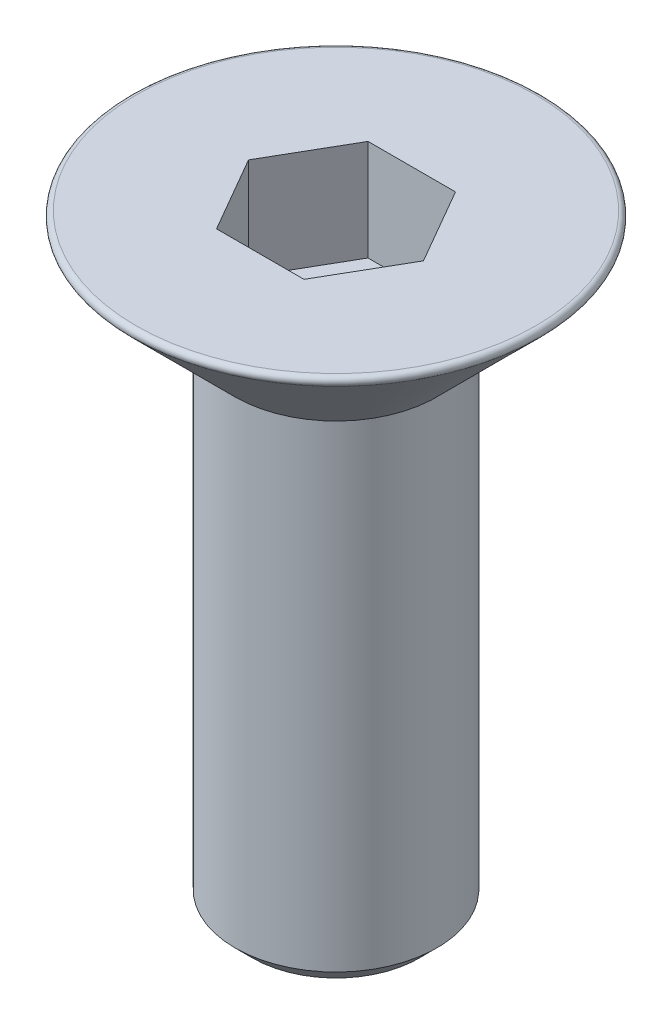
SolidWorks part; units mm, degrees
ref_plane "Plan1" through (0, 0, 0) normal (0, 0, 1) x (1, 0, 0)
ref_plane "Plan2" through (0, 0, 0) normal (0, 1, 0) x (1, 0, 0)
ref_plane "Plan3" through (0, 0, 0) normal (1, 0, 0) x (0, 0, -1)
sketch "Esquisse1" plane through (0, 0, 0) normal (0, 0, 1) x (1, 0, 0)
  line L0 (0, 7.3507) -> (0, -15.1588) construction
  line L1 (0, 0) -> (4.2, 0)
  line L2 (4.2, 0) -> (2, -2.2)
  line L3 (2, -2.2) -> (2, -12)
  line L4 (2, -12) -> (0, -12)
  line L5 (0, -12) -> (0, 0)
  dimension "D1" = 45
  dimension "D2" = 4
  dimension "D3" = 8.4
  dimension "D4" = 12
revolve "Base-Révolution" add sketch "Esquisse1" angle 360 about L0
sketch "Esquisse2" plane through (-0.4184, 0, 2.0942) normal (0, 1, 0) x (-1, 0, 0)
  line L0 (-0.4184, 0.1336) -> (-0.4184, -9.7892) construction
  line L1 (-2.9949, -2.0942) -> (7.5971, -2.0942) construction
  line L2 (0.4476, -0.5942) -> (1.3136, -2.0942)
  line L3 (0.4476, -0.5942) -> (-1.2844, -0.5942)
  line L4 (-1.2844, -0.5942) -> (-2.1505, -2.0942)
  line L5 (0.4476, -3.5942) -> (1.3136, -2.0942)
  line L6 (-1.2844, -3.5942) -> (-2.1505, -2.0942)
  line L7 (0.4476, -3.5942) -> (-1.2844, -3.5942)
  circle A0 centre (-0.4184, -2.0942) radius 1.7321 construction
  point P13 (-0.4184, -0.5942)
  dimension "D1" = 3
extrude "Enlèv. mat.-Extru.1" cut sketch "Esquisse2" against normal blind 2
chamfer "Chanfrein1" distance 0.35 angle 45
fillet "Congé1" radius 0.1
